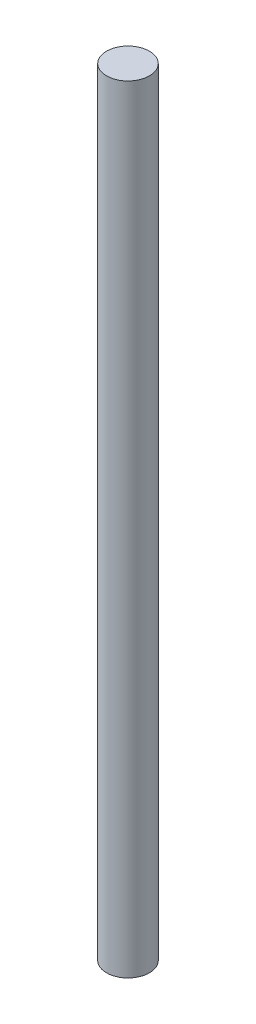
SolidWorks part; units mm, degrees
ref_plane "Front Plane" through (0, 0, 0) normal (0, 0, 1) x (1, 0, 0)
ref_plane "Top Plane" through (0, 0, 0) normal (0, 1, 0) x (1, 0, 0)
ref_plane "Right Plane" through (0, 0, 0) normal (1, 0, 0) x (0, 0, -1)
sketch "Sketch1" plane through (0, 0, 0) normal (0, 1, 0) x (1, 0, 0)
  circle A0 centre (0, 0) radius 4
  dimension "D1" = 8
extrude "Boss-Extrude1" add sketch "Sketch1" along normal mid plane 145
sketch "Sketch2" plane through (0, -72.5, 0) normal (0, -1, 0) x (1, 0, 0)
  point P0 (0, 0)
